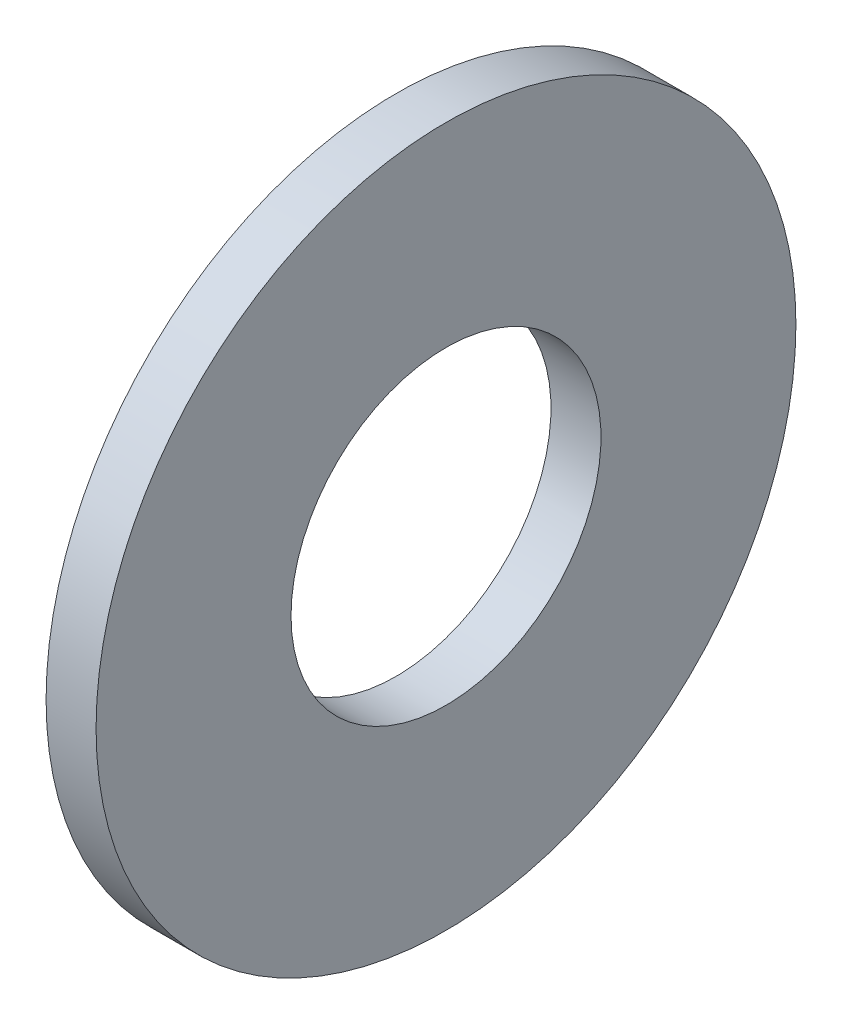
SolidWorks part; units mm, degrees
ref_plane "Face" through (0, 0, 0) normal (0, 0, 1) x (1, 0, 0)
ref_plane "Dessus" through (0, 0, 0) normal (0, 1, 0) x (1, 0, 0)
ref_plane "Droite" through (0, 0, 0) normal (1, 0, 0) x (0, 0, -1)
sketch "Esquisse1" plane through (0, 0, 0) normal (0, 0, 1) x (1, 0, 0)
  line L0 (-33.3806, 0) -> (43.5314, 0) construction
  line L2 (0, 3.1) -> (1, 3.1)
  line L3 (0, 3.1) -> (0, 7)
  line L4 (0, 7) -> (1, 7)
  line L5 (1, 3.1) -> (1, 7)
  dimension "D1" = 1
  dimension "D2" = 3.1
  dimension "D3" = 7
revolve "Révolution1" add sketch "Esquisse1" angle 360 about L0
